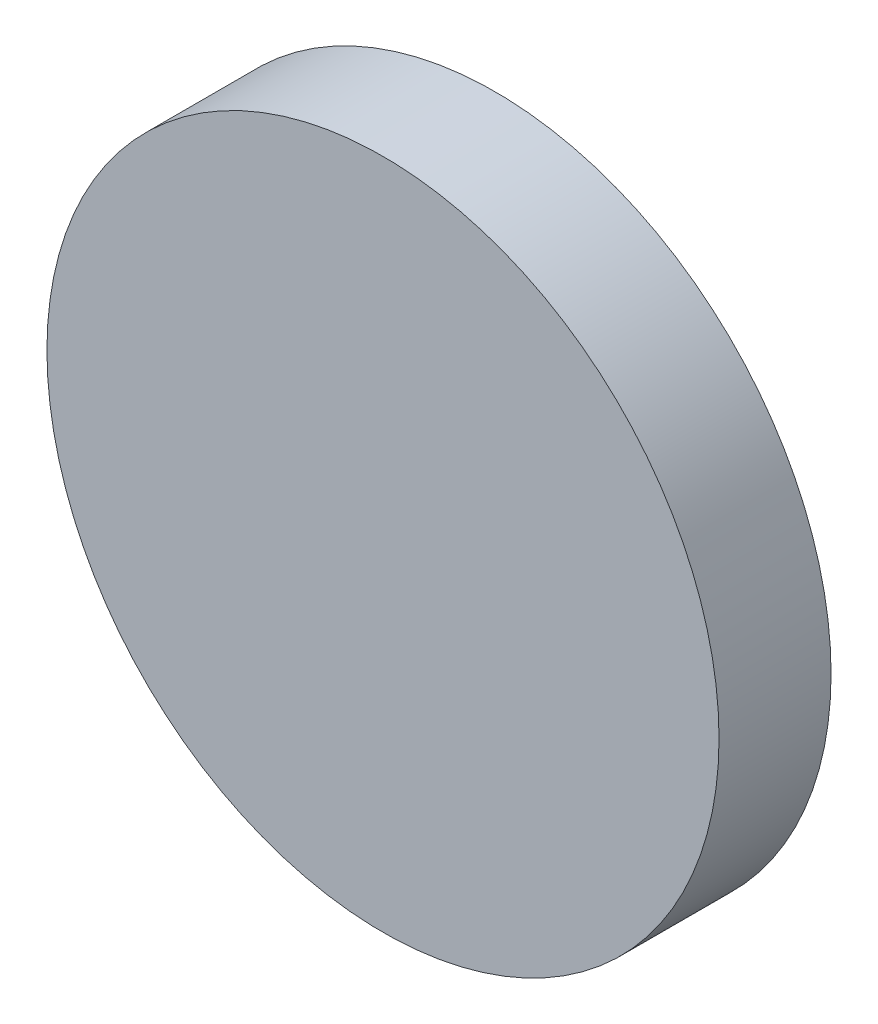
SolidWorks part; units mm, degrees
ref_plane "Face" through (0, 0, 0) normal (0, 0, 1) x (1, 0, 0)
ref_plane "Dessus" through (0, 0, 0) normal (0, 1, 0) x (1, 0, 0)
ref_plane "Droite" through (0, 0, 0) normal (1, 0, 0) x (0, 0, -1)
sketch "Esquisse1" plane through (0, 0, 0) normal (0, 0, 1) x (1, 0, 0)
  circle A0 centre (0, 0) radius 9
  dimension "D1" = 18
extrude "Extrusion1" add sketch "Esquisse1" along normal blind 3
